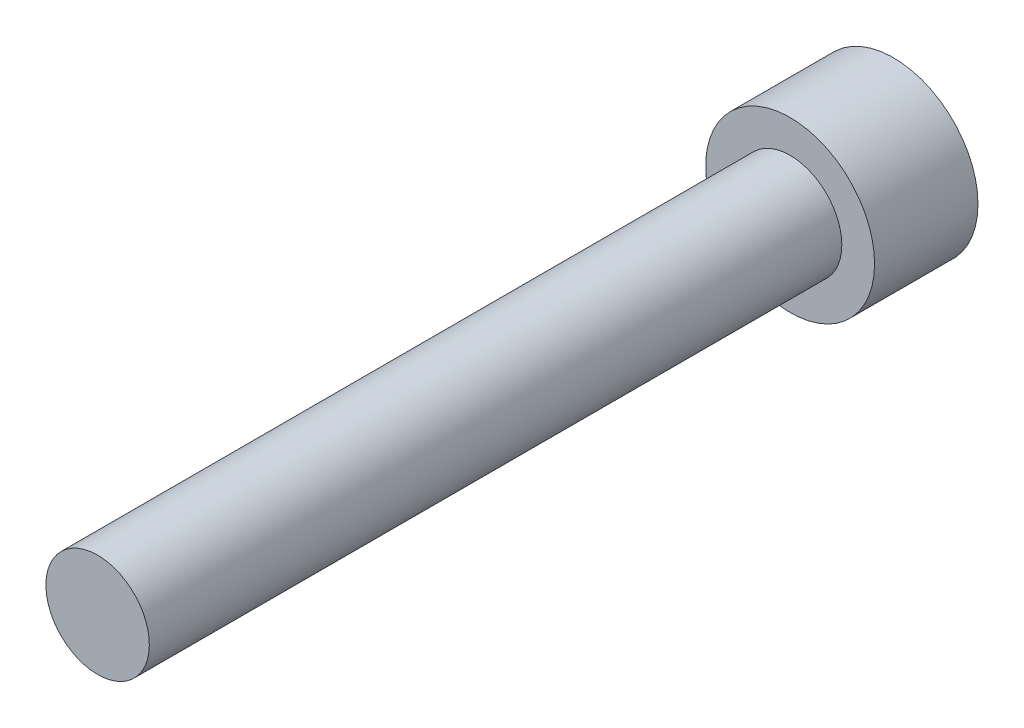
SolidWorks part; units mm, degrees
ref_plane "Front Plane" through (0, 0, 0) normal (0, 0, 1) x (1, 0, 0)
ref_plane "Top Plane" through (0, 0, 0) normal (0, 1, 0) x (1, 0, 0)
ref_plane "Right Plane" through (0, 0, 0) normal (1, 0, 0) x (0, 0, -1)
sketch "Sketch6" plane through (0, 0, 0) normal (1, 0, 0) x (0, 0, -1)
  line L0 (-19.05, 0) -> (22.525, 0) construction
  line L1 (2.5565, 0) -> (-2.5565, 0) construction
  line L2 (-19.05, 0) -> (-19.05, -1.4224)
  line L3 (-19.05, -1.4224) -> (0, -1.4224)
  line L4 (0, 2.5565) -> (0, -2.5565) construction
  line L5 (0, -1.4224) -> (0, -2.3241)
  line L6 (0, -2.3241) -> (2.8448, -2.3241)
  line L7 (2.8448, -2.3241) -> (2.8448, 0)
  line L8 (2.8448, 0) -> (-19.05, 0)
  dimension "L" = 19.05
  dimension "H" = 2.8448
  dimension "A" = 4.6482
  dimension "D" = 2.8448
revolve "Revolve1" add sketch "Sketch6" angle 360 about L0
sketch "Sketch7" plane through (0, 0, -2.8448) normal (0, 0, -1) x (-1, 0, 0)
  line L2 (-1.1811, 0.6819) -> (-1.1811, -0.6819)
  line L4 (-1.1811, -0.6819) -> (0, -1.3638)
  line L5 (0, -1.3638) -> (1.1811, -0.6819)
  line L6 (1.1811, -0.6819) -> (1.1811, 0.6819)
  line L7 (1.1811, 0.6819) -> (0, 1.3638)
  line L8 (0, 1.3638) -> (-1.1811, 0.6819)
  circle A0 centre (0, 0) radius 1.1811 construction
  dimension "J" = 2.3622
extrude "HEX" cut sketch "Sketch7" against normal blind 1.778
